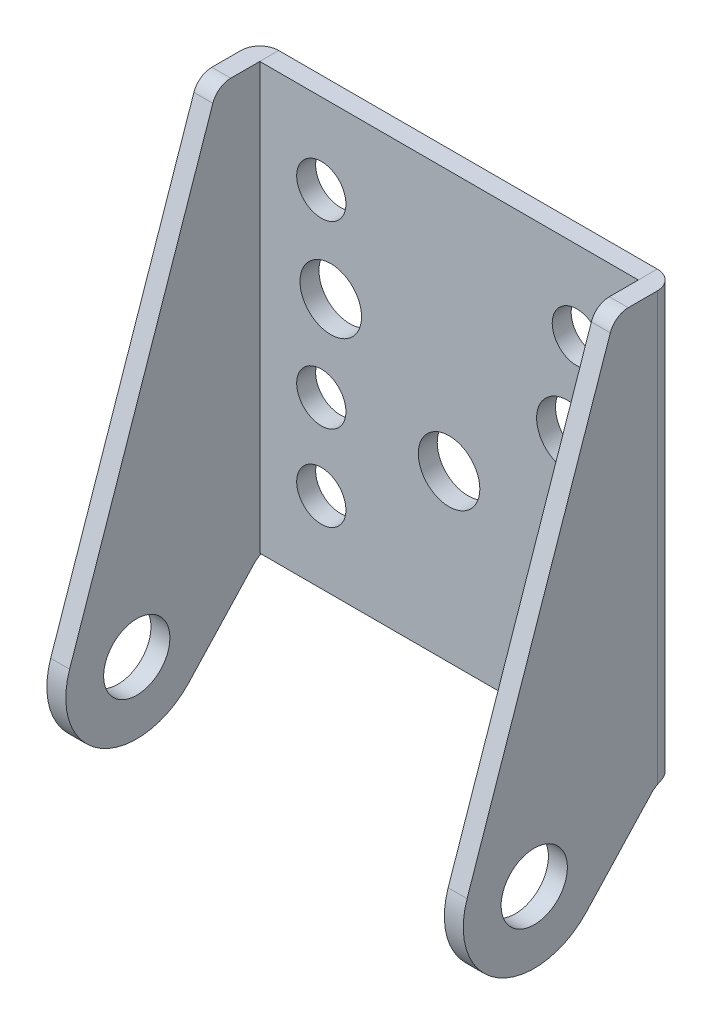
SolidWorks part; units mm, degrees
ref_plane "Front" through (0, 0, 0) normal (0, 0, 1) x (1, 0, 0)
ref_plane "Top" through (0, 0, 0) normal (0, 1, 0) x (1, 0, 0)
ref_plane "Right" through (0, 0, 0) normal (1, 0, 0) x (0, 0, -1)
sketch "Esquisse1" plane through (0, 0, 0) normal (0, 0, 1) x (1, 0, 0)
  line L1 (-20, 22.5) -> (20, 22.5)
  line L2 (-20, 22.5) -> (-20, -22.5)
  line L3 (-20, -22.5) -> (20, -22.5)
  line L4 (20, 22.5) -> (20, -22.5)
  line L5 (-20, 22.5) -> (20, -22.5) construction
  line L6 (-20, -22.5) -> (20, 22.5) construction
  point P0 (0, 0)
  dimension "D1" = 40
  dimension "D2" = 45
extrude "Boss.-Extru.1" add sketch "Esquisse1" along normal blind 2
sketch "Esquisse2" plane through (20, 0, 0) normal (1, 0, 0) x (0, 0, -1)
  line L0 (0, 22.5) -> (-6.5, 22.5)
  line L1 (-6.5, 22.5) -> (-22.096, -23.0715)
  line L2 (-2, -22.5) -> (-9.4971, -30.5959)
  line L3 (0, -22.5) -> (0, 22.5)
  line L4 (-2, -22.5) -> (0, -22.5) construction
  line L5 (0, -22.5) -> (0, 22.5) construction
  line L6 (-2, 22.5) -> (0, 22.5) construction
  line L7 (-2, -22.5) -> (0, -22.5)
  arc A0 (-22.096, -23.0715) -> (-9.4971, -30.5959) centre (-15, -25.5) ccw
  circle A1 centre (-15, -25.5) radius 3.5
  dimension "D3" = 15
  dimension "D5" = 7
  dimension "D1" = 6.5
  dimension "D2" = 15
  dimension "D4" = 48
extrude "Boss.-Extru.2" add sketch "Esquisse2" along normal blind 2 separate body
fillet "Congé1" radius 2 2 edges at (21, 22.5, 6.5) (21, -22.5, 2)
mirror "Symétrie4" about plane through (0, 0, 0) normal (1, 0, 0)
fillet "Congé2" radius 2 1 edges at (-22, 0, 0)
fillet "Congé3" radius 2 1 edges at (22, 0, 0)
sketch "Esquisse3" plane through (0, 0, 0) normal (0, 0, -1) x (-1, 0, 0)
  line L0 (0, 0) -> (0, -22.5) construction
  line L1 (20, -22.5) -> (-20, -22.5) construction
  line L2 (-13.5, -22.5) -> (-13.5, 22.5) construction
  line L3 (-20, 22.5) -> (20, 22.5) construction
  line L4 (-12.5, 7.75) -> (-12.5, 1.25) construction
  circle A0 centre (0, -5) radius 3.25
  circle A1 centre (-13.5, -14) radius 2.6
  circle A2 centre (-13.5, 14) radius 2.6
  circle A3 centre (-12.5, 4.5) radius 3.25
  circle A4 centre (-13.5, -5) radius 2.6
  circle A5 centre (13.5, -14) radius 2.6
  circle A6 centre (13.5, -5) radius 2.6
  circle A7 centre (12.5, 4.5) radius 3.25
  circle A8 centre (13.5, 14) radius 2.6
  dimension "D1" = 6.5
  dimension "D3" = 5.2
  dimension "D5" = 5.2
  dimension "D9" = 6.5
  dimension "D10" = 5.2
  dimension "D12" = 17.5
  dimension "D2" = 13.5
  dimension "D4" = 8.5
  dimension "D6" = 8.5
  dimension "D7" = 12.5
  dimension "D8" = 18
  dimension "D11" = 9
extrude "Enlèv. mat.-Extru.1" cut sketch "Esquisse3" against normal blind 10
ref_plane "Plan1" through (0, 0, 0) normal (-1, 0, 0) x (0, 0, 1)
